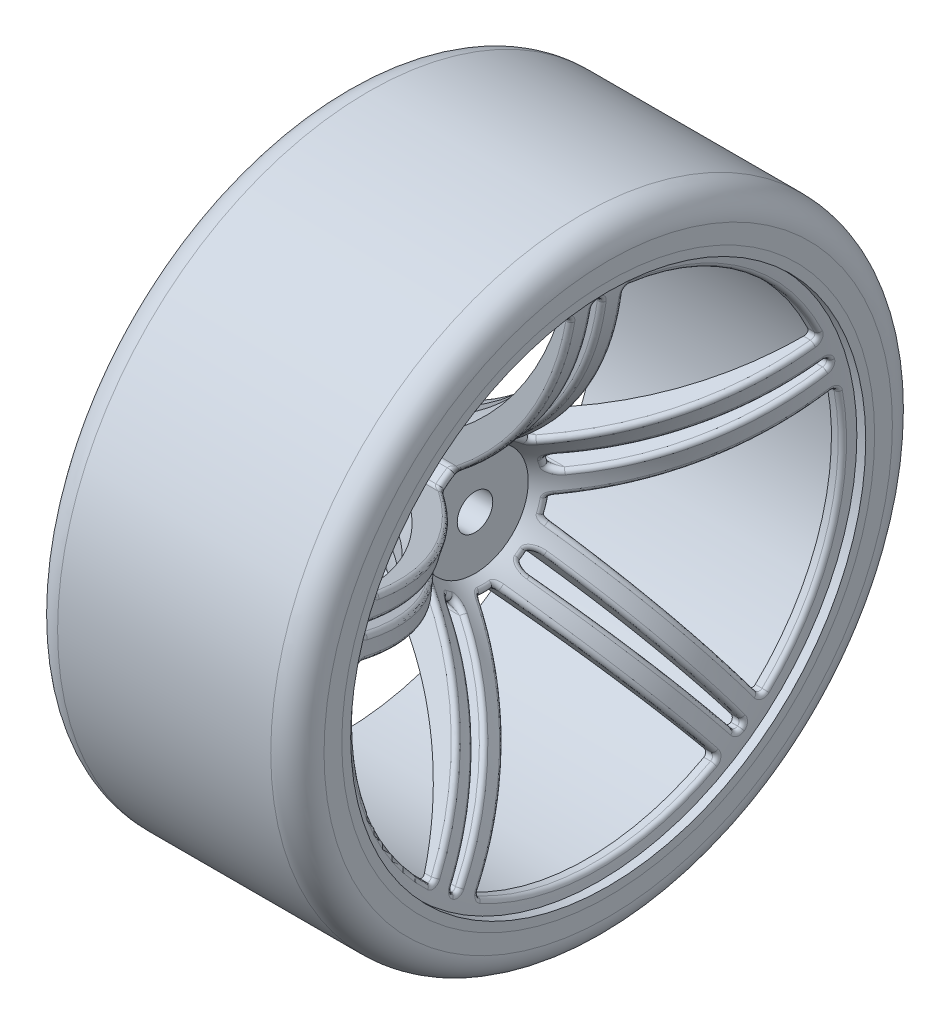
SolidWorks part; units mm, degrees
ref_plane "正面" through (0, 0, 0) normal (0, 0, 1) x (1, 0, 0)
ref_plane "平面" through (0, 0, 0) normal (0, 1, 0) x (1, 0, 0)
ref_plane "右側面" through (0, 0, 0) normal (1, 0, 0) x (0, 0, -1)
sketch "ｽｹｯﾁ1" plane through (0, 0, 0) normal (1, 0, 0) x (0, 0, -1)
  circle A0 centre (0, 0) radius 35
  dimension "D1" = 70
extrude "押し出し1" add sketch "ｽｹｯﾁ1" along normal blind 30
sketch "ｽｹｯﾁ4" plane through (0, 0, 0) normal (1, 0, 0) x (0, 0, -1)
  circle A0 centre (0, 0) radius 20
  dimension "D1" = 40
extrude "押し出し2" cut sketch "ｽｹｯﾁ4" along normal blind 10
sketch "ｽｹｯﾁ5" plane through (10, 0, 0) normal (-1, 0, 0) x (0, 0, 1)
  circle A0 centre (0, 0) radius 3
  dimension "D1" = 6
extrude "押し出し3" add sketch "ｽｹｯﾁ5" along normal blind 5
fillet "ﾌｨﾚｯﾄ1" radius 5 1 edges at (10, 0, -3)
sketch "ｽｹｯﾁ6" plane through (0, 0, 0) normal (1, 0, 0) x (0, 0, -1)
  circle A0 centre (0, 0) radius 2
  dimension "D1" = 4
extrude "押し出し4" cut sketch "ｽｹｯﾁ6" along normal through all
sketch "ｽｹｯﾁ7" plane through (0, 0, 0) normal (1, 0, 0) x (0, 0, -1)
  circle A0 centre (0, 0) radius 30
  dimension "D1" = 60
surface "ｻｰﾌｪｽ-押し出し1" sketch "ｽｹｯﾁ7" parameters "D1"=40
split "部品分割1"
other "タイヤ"
other "ホイール"
sketch "ｽｹｯﾁ9" plane through (0, 0, 0) normal (0, 0, 1) x (1, 0, 0)
  line L0 (29, 29) -> (30, 29)
  line L3 (15, 6) -> (15, 0)
  line L4 (15, 0) -> (30, 0)
  line L5 (30, -35) -> (30, 35) construction
  line L6 (30, 0) -> (30, 29)
  line L7 (-2, 0) -> (34.0373, 0) construction
  arc A0 (29, 29) -> (15, 6) centre (-0.9006, 31.4395) cw
  dimension "D2" = 58
  dimension "D4" = 30
  dimension "D1" = 1
  dimension "D3" = 12
  dimension "D5" = 15
revolve "ｶｯﾄ - 回転1" cut sketch "ｽｹｯﾁ9" angle 360 about L7
sketch "ｽｹｯﾁ10" plane through (0, 0, 0) normal (0, 0, 1) x (1, 0, 0)
  line L0 (-3.9397, 0) -> (35.0136, 0) construction
  line L1 (0, 7.5) -> (10, 7.5)
  line L2 (0, 35) -> (0, -35) construction
  line L3 (10, 20) -> (10, -20) construction
  line L4 (28, 29) -> (0, 29)
  line L5 (0, 29) -> (0, 7.5)
  line L6 (30, 29) -> (29, 29) construction
  line L7 (30, -35) -> (30, 35) construction
  arc A0 (10, 7.5) -> (28, 29) centre (-1.3363, 35.2757) ccw
  dimension "D2" = 30
  dimension "D1" = 15
  dimension "D3" = 2
revolve "ｶｯﾄ - 回転2" cut sketch "ｽｹｯﾁ10" angle 360 about L0
sketch "ｽｹｯﾁ12" plane through (0, 0, 0) normal (1, 0, 0) x (0, 0, -1)
  line L0 (0, 0) -> (0, 39.7343) construction
  line L1 (-3, 27.3359) -> (-3.5, 6.6332)
  line L2 (-0.4954, 27.4955) -> (-0.9799, 7.4357)
  line L3 (0.4954, 27.4955) -> (0.9799, 7.4357)
  line L4 (3, 27.3359) -> (3.5, 6.6332)
  line L5 (25.0709, 11.3004) -> (5.227, 5.3785)
  line L6 (25.9967, 8.9678) -> (6.769, 3.2297)
  line L7 (26.3029, 8.0254) -> (7.3746, 1.3658)
  line L8 (26.925, 5.5941) -> (7.3902, -1.2789)
  line L9 (18.4947, -20.3518) -> (6.7305, -3.3092)
  line L10 (16.5623, -21.9532) -> (5.1633, -5.4397)
  line L11 (15.7607, -22.5356) -> (3.5779, -6.5916)
  line L12 (13.6406, -23.8785) -> (1.0674, -7.4237)
  line L13 (-13.6406, -23.8785) -> (-1.0674, -7.4237)
  line L14 (-15.7607, -22.5356) -> (-3.5779, -6.5916)
  line L15 (-16.5623, -21.9532) -> (-5.1633, -5.4397)
  line L16 (-18.4947, -20.3518) -> (-6.7305, -3.3092)
  line L17 (-26.925, 5.5941) -> (-7.3902, -1.2789)
  line L18 (-26.3029, 8.0254) -> (-7.3746, 1.3658)
  line L19 (-25.9967, 8.9678) -> (-6.769, 3.2297)
  line L20 (-25.0709, 11.3004) -> (-5.227, 5.3785)
  circle A0 centre (0, 0) radius 7.5
  circle A1 centre (0, 0) radius 27.5
  dimension "D1" = 15
  dimension "D2" = 55
  dimension "D3" = 2.5
  dimension "D4" = 6
  dimension "D5" = 7
sketch "ｽｹｯﾁ13" plane through (0, 0, 0) normal (1, 0, 0) x (0, 0, -1)
  line L2 (0.4954, 27.4955) -> (0.9799, 7.4357) construction
  line L3 (-0.4954, 27.4955) -> (-0.9799, 7.4357) construction
  line L5 (-3, 27.3359) -> (-3.5, 6.6332) construction
  line L7 (-25.0709, 11.3004) -> (-5.227, 5.3785) construction
  line L8 (0.4954, 27.4955) -> (0.9799, 7.4357)
  line L9 (-0.4954, 27.4955) -> (-0.9799, 7.4357)
  line L10 (-3, 27.3359) -> (-3.5, 6.6332)
  line L11 (-25.0709, 11.3004) -> (-5.227, 5.3785)
  circle A2 centre (0, 0) radius 7.5 construction
  circle A3 centre (0, 0) radius 27.5 construction
  arc A4 (0.9799, 7.4357) -> (-0.9799, 7.4357) centre (0, 0) ccw
  arc A5 (0.4954, 27.4955) -> (-0.4954, 27.4955) centre (0, 0) ccw
  arc A6 (-3.5, 6.6332) -> (-5.227, 5.3785) centre (0, 0) ccw
  arc A7 (-3, 27.3359) -> (-25.0709, 11.3004) centre (0, 0) ccw
extrude "押し出し5" cut sketch "ｽｹｯﾁ13" along normal through all
fillet "ﾌｨﾚｯﾄ2" radius 0.5 8 edges at (13.5899, 7.4357, -0.9799) (13.5899, 7.4357, 0.9799) (13.5899, 6.6332, 3.5) (13.5899, 5.3785, 5.227) (28.2391, 27.4955, 0.4954) (28.2391, 27.4955, -0.4954) (28.2391, 27.3359, 3) (28.2391, 11.3004, 25.0709)
fillet "ﾌｨﾚｯﾄ3" radius 0.5 16 edges at (28.8253, 27.392, -0.3177) (28.8396, 27.5, 0) (28.8161, 27.3239, 0.3882) (23.7248, 14.2819, 0.8145) (17.2507, 7.525, 0.659) (17.1797, 7.5, 0) (17.3622, 7.5987, -0.7822) (17.2507, 5.4592, 5.2208) (17.1797, 6.0676, 4.4084) (17.2427, 6.6413, 3.5864) (25.7851, 17.4345, 3.2391) (28.8084, 27.0914, 3.1305) (28.8396, 22.248, 16.1641) (28.8061, 11.3324, 24.7873) (25.8518, 17.8488, -0.7284) (23.5177, 7.374, 11.9138)
pattern_circular "円形ﾊﾟﾀｰﾝ3" count 5 over 360 of "ﾌｨﾚｯﾄ3", "ﾌｨﾚｯﾄ2", "押し出し5"
fillet "ﾌｨﾚｯﾄ4" radius 3 2 edges at (0, 0, -35) (30, 0, -35)
